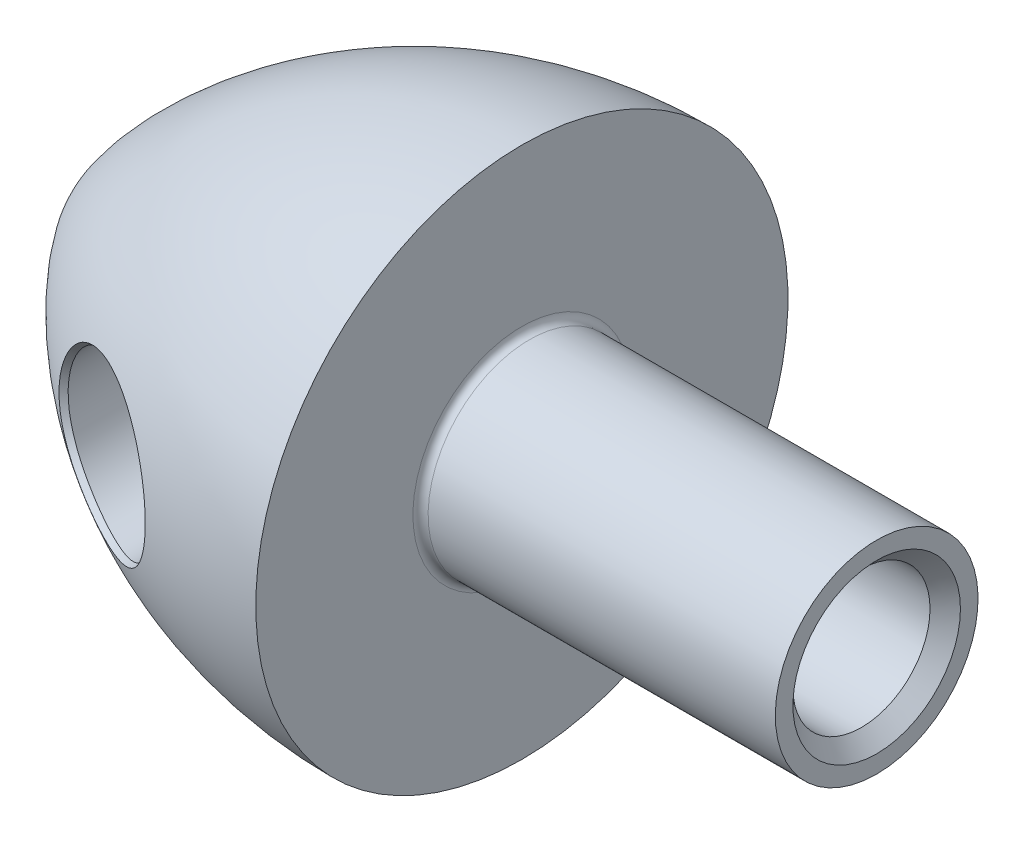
SolidWorks part; units mm, degrees
ref_plane "Front Plane" through (0, 0, 0) normal (0, 0, 1) x (1, 0, 0)
ref_plane "Top Plane" through (0, 0, 0) normal (0, 1, 0) x (1, 0, 0)
ref_plane "Right Plane" through (0, 0, 0) normal (1, 0, 0) x (0, 0, -1)
sketch "Sketch1" plane through (0, 0, 0) normal (0, 0, 1) x (1, 0, 0)
  line L0 (0, 0) -> (-30.8152, 0) construction
  line L1 (0, 0) -> (0, 4)
  line L2 (0, 4) -> (-14, 4)
  line L3 (-14, 4) -> (-14, 10.5)
  line L4 (-14, 10.5) -> (-21.9755, 10.5) construction
  line L5 (-30.8152, 0) -> (0, 0)
  arc A0 (-29.9586, 2.555) -> (-30.8152, 0) centre (-26.5762, 0) ccw
  arc A1 (-14, 10.5) -> (-29.9586, 2.555) centre (-14, -9.5) ccw
  dimension "D4" = 20
  dimension "D5" = 4.2389
  dimension "D1" = 4
  dimension "D2" = 10.5
  dimension "D3" = 14
revolve "Revolve1" add sketch "Sketch1" angle 360 about L5
hole_wizard "1/4-28 Tapped Hole1" positions "Sketch3" profile "Sketch2" tap size "1/4-28" standard "ANSI Inch"
sketch "Sketch3" plane through (0, 0, 0) normal (1, 0, 0) x (0, 0, -1)
  point P0 (0, 0)
sketch "Sketch2" plane through (0, 0, 0) normal (0, 1, 0) x (0, 0, -1)
  line L0 (0, 0) -> (0, 23.6254)
  line L1 (0, 23.6254) -> (2.7051, 22)
  line L2 (2.7051, 22) -> (2.7051, 0)
  line L5 (2.7051, 0) -> (0, 0)
  line L10 (0, 23.6254) -> (-2.7051, 22) construction
  line L11 (0, -6.35) -> (0, 107.95) construction
  dimension "Tap Drill Dia." = 5.4102
  dimension "Tap Drill Depth" = 22
  dimension "Drill Angle" = 118
sketch "Sketch4" plane through (0, 0, 0) normal (0, 0, 1) x (1, 0, 0)
  line L0 (-14, -10.5) -> (-14, 10.5) construction
  circle A0 centre (-22, 0) radius 3
  dimension "D1" = 6
  dimension "D2" = 8
extrude "Cut-Extrude1" cut sketch "Sketch4" against normal mid plane 30
fillet "Fillet1" radius 0.3 1 edges at (-14, -4, 0)
chamfer "Chamfer1" distance 0.3 angle 45 2 edges at (-20.0949, 2.3174, -9.2632) (-19.1276, 0.8658, 9.7933)
chamfer "Chamfer2" distance 0.6 angle 45 1 edges at (0, 0, -2.7051)
